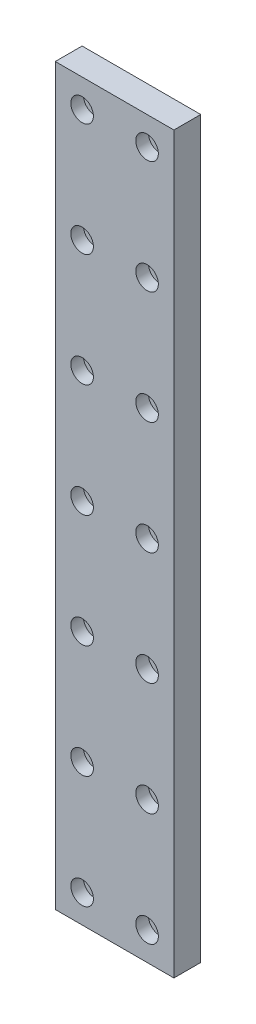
SolidWorks part; units mm, degrees
ref_plane "前基準面" through (0, 0, 0) normal (0, 0, 1) x (1, 0, 0)
ref_plane "上基準面" through (0, 0, 0) normal (0, 1, 0) x (1, 0, 0)
ref_plane "右基準面" through (0, 0, 0) normal (1, 0, 0) x (0, 0, -1)
sketch "草圖1" plane through (0, 0, 0) normal (0, 0, 1) x (1, 0, 0)
  line L1 (-21, 130) -> (21, 130)
  line L2 (-21, 130) -> (-21, -130)
  line L3 (-21, -130) -> (21, -130)
  line L4 (21, 130) -> (21, -130)
  line L5 (-21, 130) -> (21, -130) construction
  line L6 (-21, -130) -> (21, 130) construction
  point P0 (0, 0)
  dimension "D1" = 42
  dimension "D2" = 260
extrude "填料-伸長1" add sketch "草圖1" along normal blind 9.5
sketch "草圖2" plane through (0, 0, 9.5) normal (0, 0, 1) x (1, 0, 0)
  line L0 (0, 130) -> (0, -130) construction
  line L1 (21, 130) -> (-21, 130) construction
  line L2 (-21, -130) -> (21, -130) construction
  line L3 (-11.5, 130) -> (-11.5, -130) construction
  line L4 (11.5, 130) -> (11.5, -130) construction
  circle A1 centre (-11.5, 120) radius 2.25
  circle A11 centre (11.5, 120) radius 2.25
  circle A13 centre (-11.5, 80) radius 2.25
  circle A14 centre (11.5, 80) radius 2.25
  circle A15 centre (-11.5, 40) radius 2.25
  circle A16 centre (11.5, 40) radius 2.25
  circle A17 centre (-11.5, 0) radius 2.25
  circle A18 centre (11.5, 0) radius 2.25
  circle A19 centre (-11.5, -40) radius 2.25
  circle A20 centre (11.5, -40) radius 2.25
  circle A21 centre (-11.5, -80) radius 2.25
  circle A22 centre (11.5, -80) radius 2.25
  circle A23 centre (-11.5, -120) radius 2.25
  circle A24 centre (11.5, -120) radius 2.25
  dimension "D2" = 10
  dimension "D3" = 4.5
  dimension "D4" = 7
  dimension "D5" = 10
  dimension "D1" = 11.5
extrude "除料-伸長1" cut sketch "草圖2" against normal through all
sketch "草圖3" plane through (0, 0, 9.5) normal (0, 0, 1) x (1, 0, 0)
  line L0 (0, 130) -> (0, -130) construction
  line L1 (21, 130) -> (-21, 130) construction
  line L2 (-21, -130) -> (21, -130) construction
  line L3 (-11.5, 130) -> (-11.5, -130) construction
  circle A0 centre (-11.5, 120) radius 4
  circle A6 centre (11.5, 120) radius 4
  circle A12 centre (-11.5, 80) radius 4
  circle A13 centre (11.5, 80) radius 4
  circle A14 centre (-11.5, 40) radius 4
  circle A15 centre (11.5, 40) radius 4
  circle A16 centre (-11.5, 0) radius 4
  circle A17 centre (11.5, 0) radius 4
  circle A18 centre (-11.5, -40) radius 4
  circle A19 centre (11.5, -40) radius 4
  circle A20 centre (-11.5, -80) radius 4
  circle A21 centre (11.5, -80) radius 4
  circle A22 centre (-11.5, -120) radius 4
  circle A23 centre (11.5, -120) radius 4
  dimension "D2" = 8
  dimension "D4" = 10
  dimension "D1" = 11.5
  dimension "D3" = 7
extrude "除料-伸長2" cut sketch "草圖3" against normal blind 4.5
